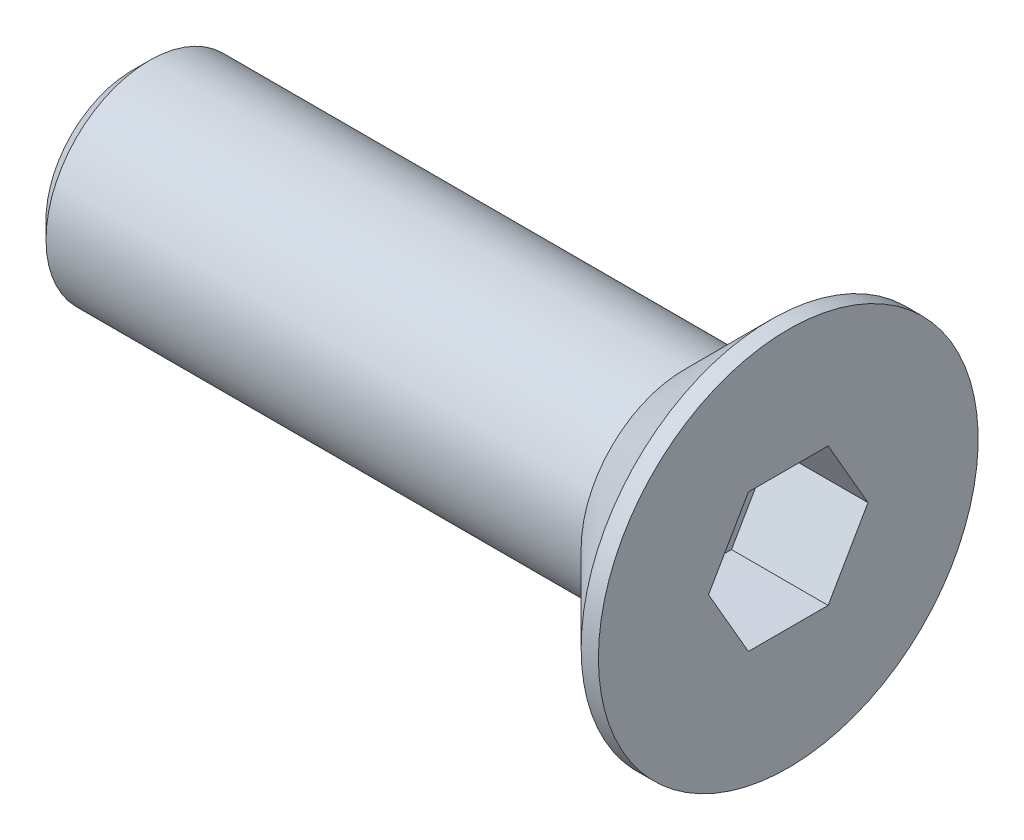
SolidWorks part; units mm, degrees
ref_plane "Plan1" through (0, 0, 0) normal (0, 0, 1) x (1, 0, 0)
ref_plane "Plan2" through (0, 0, 0) normal (0, 1, 0) x (1, 0, 0)
ref_plane "Plan3" through (0, 0, 0) normal (1, 0, 0) x (0, 0, -1)
sketch "Esquisse1" plane through (0, 0, 0) normal (0, 0, 1) x (1, 0, 0)
  line L0 (-25.8285, 0) -> (47.3208, 0) construction
  line L1 (0, 0) -> (0, 3)
  line L2 (0, 3) -> (16, 3)
  line L3 (16, 3) -> (18.5, 5.5)
  line L4 (19, 5.5) -> (19, 0)
  line L5 (19, 0) -> (0, 0)
  line L6 (18.5, 5.5) -> (19, 5.5)
  dimension "D1" = 6
  dimension "D2" = 16
  dimension "D3" = 45
  dimension "D4" = 11
  dimension "D5" = 3
revolve "Base-Révolution" add sketch "Esquisse1" angle 360 about L0
chamfer "Chanfrein2" distance 0.5 angle 45 1 edges at (0, 0, 3)
sketch "Esquisse2" plane through (19, 0, 0) normal (1, 0, 0) x (0, 0, -1)
  line L1 (2.3094, 0) -> (1.1547, 2)
  line L2 (1.1547, 2) -> (-1.1547, 2)
  line L3 (-1.1547, 2) -> (-2.3094, 0)
  line L4 (-2.3094, 0) -> (-1.1547, -2)
  line L5 (-1.1547, -2) -> (1.1547, -2)
  line L6 (1.1547, -2) -> (2.3094, 0)
  circle A0 centre (0, 0) radius 2 construction
  dimension "D1" = 4
extrude "Empreinte pour clé" cut sketch "Esquisse2" against normal blind 2.8
sketch "Esq_WRNL_Compact001" plane through (0, 0, 0) normal (0, 0, 1) x (1, 0, 0)
  line L0 (-1, -6.5) -> (-1, 6.5)
  line L1 (20, -6.5) -> (20, 6.5)
  line L2 (-1, -6.5) -> (20, -6.5)
  line L3 (-1, 6.5) -> (20, 6.5)
